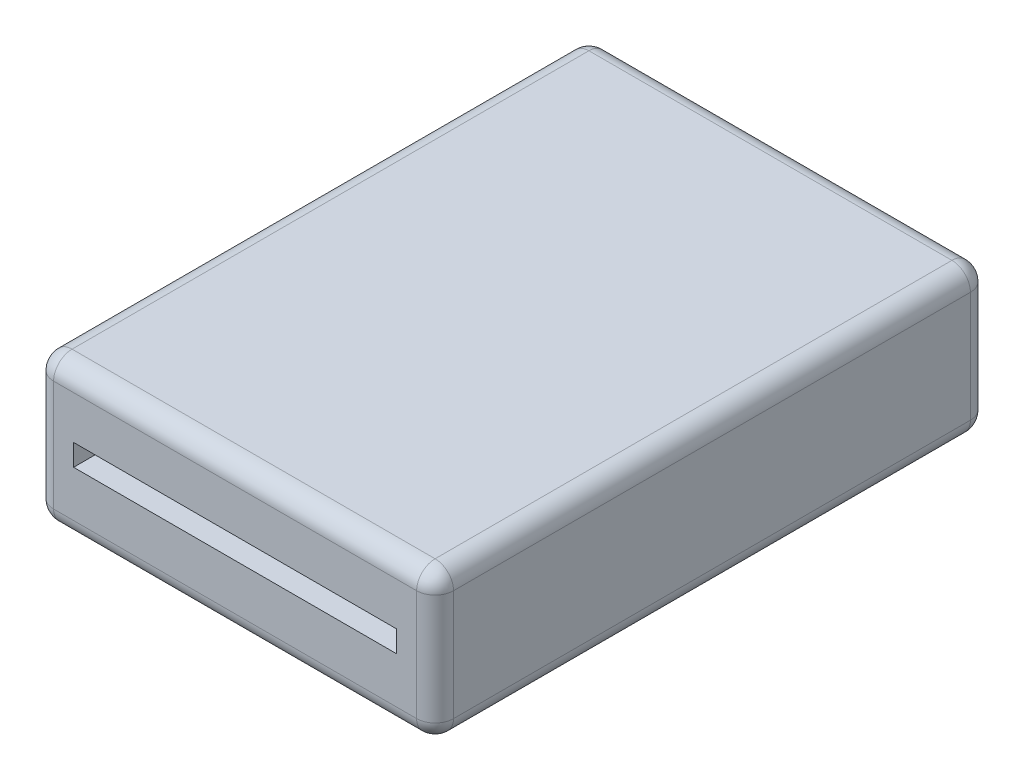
SolidWorks part; units mm, degrees
ref_plane "Front Plane" through (0, 0, 0) normal (0, 0, 1) x (1, 0, 0)
ref_plane "Top Plane" through (0, 0, 0) normal (0, 1, 0) x (1, 0, 0)
ref_plane "Right Plane" through (0, 0, 0) normal (1, 0, 0) x (0, 0, -1)
sketch "Sketch1" plane through (0, 0, 0) normal (0, 1, 0) x (1, 0, 0)
  line L1 (-29.5, -45) -> (29.5, -45)
  line L2 (-32.5, -42) -> (-32.5, 42)
  line L3 (-29.5, 45) -> (29.5, 45)
  line L4 (32.5, -42) -> (32.5, 42)
  line L5 (-32.5, -45) -> (32.5, 45) construction
  line L6 (-32.5, 45) -> (32.5, -45) construction
  arc A0 (32.5, 42) -> (29.5, 45) centre (29.5, 42) ccw
  arc A1 (32.5, -42) -> (29.5, -45) centre (29.5, -42) cw
  arc A2 (-29.5, -45) -> (-32.5, -42) centre (-29.5, -42) cw
  arc A3 (-32.5, 42) -> (-29.5, 45) centre (-29.5, 42) cw
  point P0 (0, 0)
  dimension "D3" = 3
  dimension "D1" = 90
  dimension "D2" = 65
extrude "Boss-Extrude1" add sketch "Sketch1" along normal blind 24
fillet "Fillet1" radius 3 16 edges at (0, 0, -45) (-31.6213, 0, -44.1213) (-32.5, 0, 0) (-31.6213, 0, 44.1213) (0, 0, 45) (31.6213, 0, 44.1213) (32.5, 0, 0) (31.6213, 0, -44.1213) (32.5, 24, 0) (31.6213, 24, 44.1213) (0, 24, 45) (-31.6213, 24, 44.1213) (-32.5, 24, 0) (-31.6213, 24, -44.1213) (0, 24, -45) (31.6213, 24, -44.1213)
sketch "Sketch2" plane through (0, 0, 45) normal (0, 0, 1) x (1, 0, 0)
  line L1 (-26.25, 13.9988) -> (26.25, 13.9988)
  line L2 (-26.25, 13.9988) -> (-26.25, 10.4988)
  line L3 (-26.25, 10.4988) -> (26.25, 10.4988)
  line L4 (26.25, 13.9988) -> (26.25, 10.4988)
  line L5 (-26.25, 13.9988) -> (26.25, 10.4988) construction
  line L6 (-26.25, 10.4988) -> (26.25, 13.9988) construction
  point P0 (0, 12.2488)
  dimension "D1" = 3.5
  dimension "D2" = 52.5
extrude "Cut-Extrude1" cut sketch "Sketch2" against normal blind 40
